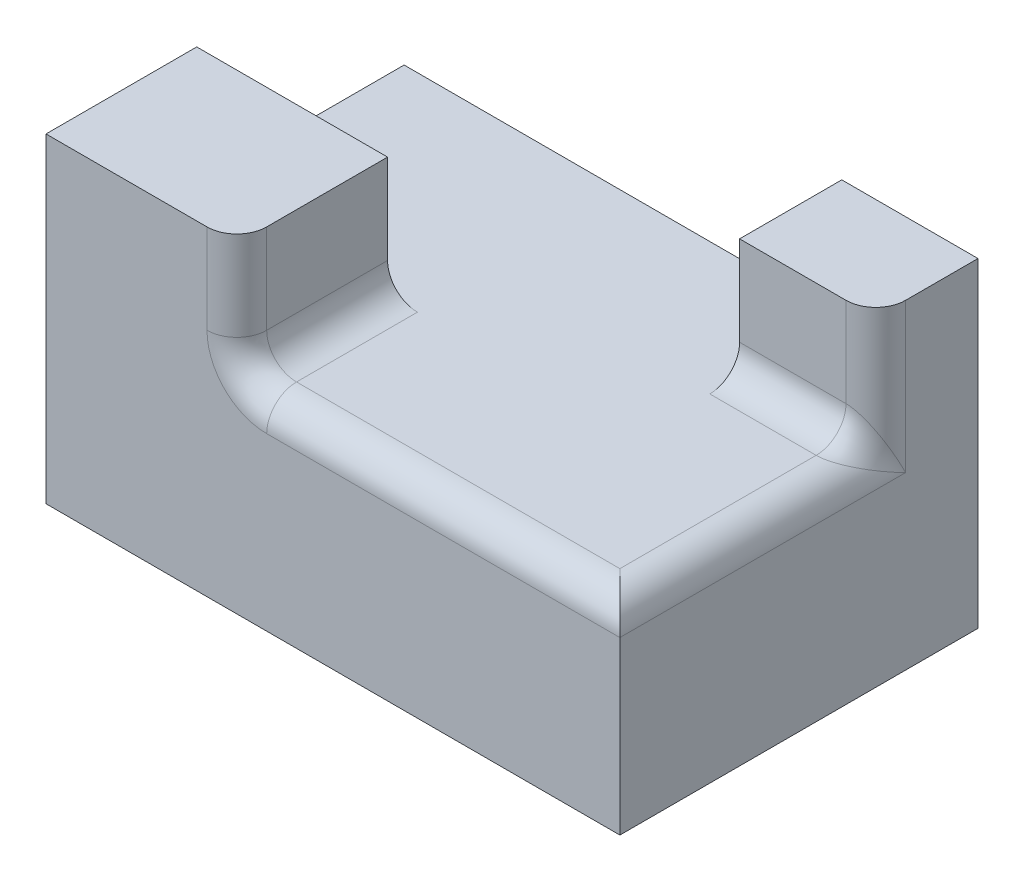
SolidWorks part; units mm, degrees
ref_plane "Front Plane" through (0, 0, 0) normal (0, 0, 1) x (1, 0, 0)
ref_plane "Top Plane" through (0, 0, 0) normal (0, 1, 0) x (1, 0, 0)
ref_plane "Right Plane" through (0, 0, 0) normal (1, 0, 0) x (0, 0, -1)
sketch "Sketch1" plane through (0, 0, 0) normal (0, 0, 1) x (1, 0, 0)
  line L1 (0, 0) -> (96.149, 0)
  line L2 (0, 0) -> (0, 33.6618)
  line L3 (0, 33.6618) -> (96.149, 33.6618)
  line L4 (96.149, 0) -> (96.149, 33.6618)
extrude "Extrude1" add sketch "Sketch1" along normal blind 60
sketch "Sketch2" plane through (0, 33.6618, 0) normal (0, 1, 0) x (1, 0, 0)
  line L1 (0, -60) -> (31.9747, -60)
  line L2 (0, -60) -> (0, -34.7454)
  line L3 (0, -34.7454) -> (31.9747, -34.7454)
  line L4 (31.9747, -60) -> (31.9747, -34.7454)
extrude "Extrude2" add sketch "Sketch2" along normal blind 20
sketch "Sketch3" plane through (0, 33.6618, 0) normal (0, 1, 0) x (1, 0, 0)
  line L1 (96.149, 0) -> (73.3248, 0)
  line L2 (96.149, 0) -> (96.149, -17.1202)
  line L3 (96.149, -17.1202) -> (73.3248, -17.1202)
  line L4 (73.3248, 0) -> (73.3248, -17.1202)
extrude "Extrude3" add sketch "Sketch3" along normal blind 20
fillet "Fillet5" radius 5 3 edges
fillet "Fillet8" radius 5 3 edges at (96.149, 33.6618, 36.0601) (84.7369, 33.6618, 17.1202) (96.149, 43.6618, 17.1202)
other "Fillet-Corner12"
other "Fillet-Corner6"
